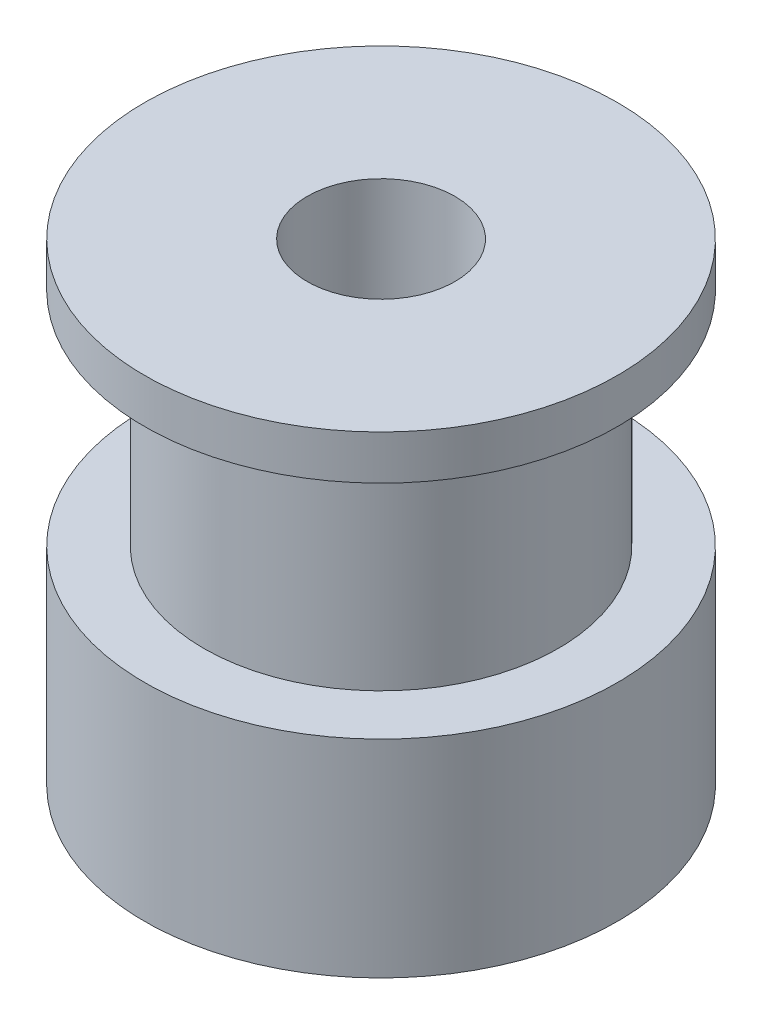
SolidWorks part; units mm, degrees
ref_plane "Спереди" through (0, 0, 0) normal (0, 0, 1) x (1, 0, 0)
ref_plane "Сверху" through (0, 0, 0) normal (0, 1, 0) x (1, 0, 0)
ref_plane "Справа" through (0, 0, 0) normal (1, 0, 0) x (0, 0, -1)
sketch "Эскиз1" plane through (0, 0, 0) normal (0, 0, 1) x (1, 0, 0)
  line L0 (0, 0) -> (0, 11.1525) construction
  line L2 (-2.5, 0) -> (-8, 0)
  line L3 (-2.5, 0) -> (-2.5, 7)
  line L4 (-2.5, 7) -> (-8, 7)
  line L5 (-8, 0) -> (-8, 7)
  line L6 (-2.5, 7) -> (-6, 7)
  line L7 (-2.5, 7) -> (-2.5, 14.5)
  line L8 (-2.5, 14.5) -> (-6, 14.5)
  line L9 (-6, 7) -> (-6, 14.5)
  line L10 (-2.5, 14.5) -> (-8, 14.5)
  line L11 (-2.5, 14.5) -> (-2.5, 16)
  line L12 (-2.5, 16) -> (-8, 16)
  line L13 (-8, 14.5) -> (-8, 16)
  dimension "D1" = 2.5
  dimension "D2" = 8
  dimension "D3" = 6
  dimension "D4" = 7
  dimension "D5" = 1.5
  dimension "D6" = 7.5
revolve "Повернуть1" add sketch "Эскиз1" angle 360 about L0
